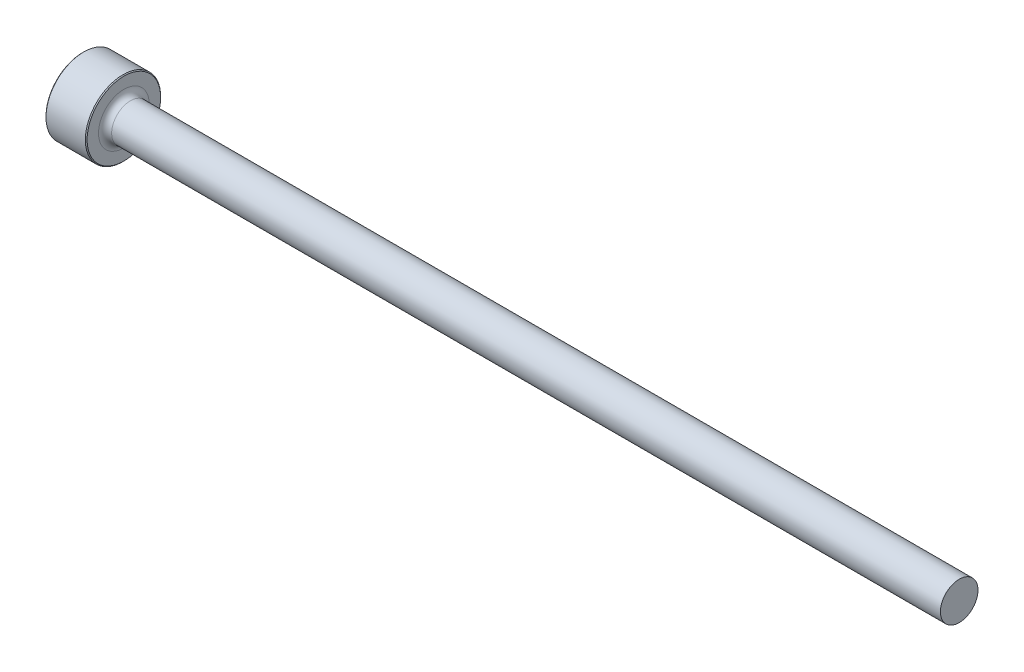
SolidWorks part; units mm, degrees
ref_plane "Front Plane" through (0, 0, 0) normal (0, 0, 1) x (1, 0, 0)
ref_plane "Top Plane" through (0, 0, 0) normal (0, 1, 0) x (1, 0, 0)
ref_plane "Right Plane" through (0, 0, 0) normal (1, 0, 0) x (0, 0, -1)
sketch "Sketch1" plane through (0, 0, 0) normal (0, 0, 1) x (1, 0, 0)
  line L0 (0, 0) -> (0, 4.3656)
  line L1 (0, 4.3656) -> (4.7625, 4.3656)
  line L2 (4.7625, 4.3656) -> (4.7625, 2.941)
  line L3 (5.5245, 2.179) -> (101.6, 2.179)
  line L4 (101.6, 2.179) -> (101.6, 0)
  line L5 (101.6, 0) -> (0, 0)
  line L6 (101.6, 0) -> (101.6, -2.179) construction
  line L7 (101.6, -2.179) -> (4.7625, -2.179) construction
  line L8 (0, 0) -> (0, -4.3656) construction
  line L9 (0, -4.3656) -> (4.7625, -4.3656) construction
  line L10 (4.7625, -4.3656) -> (4.7625, -2.179) construction
  arc A0 (4.7625, 2.941) -> (5.5245, 2.179) centre (5.5245, 2.941) ccw
  dimension "D4" = 0.762
  dimension "L" = 101.6
  dimension "D" = 4.358
  dimension "H" = 8.7312
  dimension "T" = 4.7625
revolve "Revolve1" add sketch "Sketch1" angle 360 about L5
chamfer "Chamfer1" distance 0.1016 angle 45 2 edges at (0, 4.3656, 0) (4.7625, 4.3656, 0)
